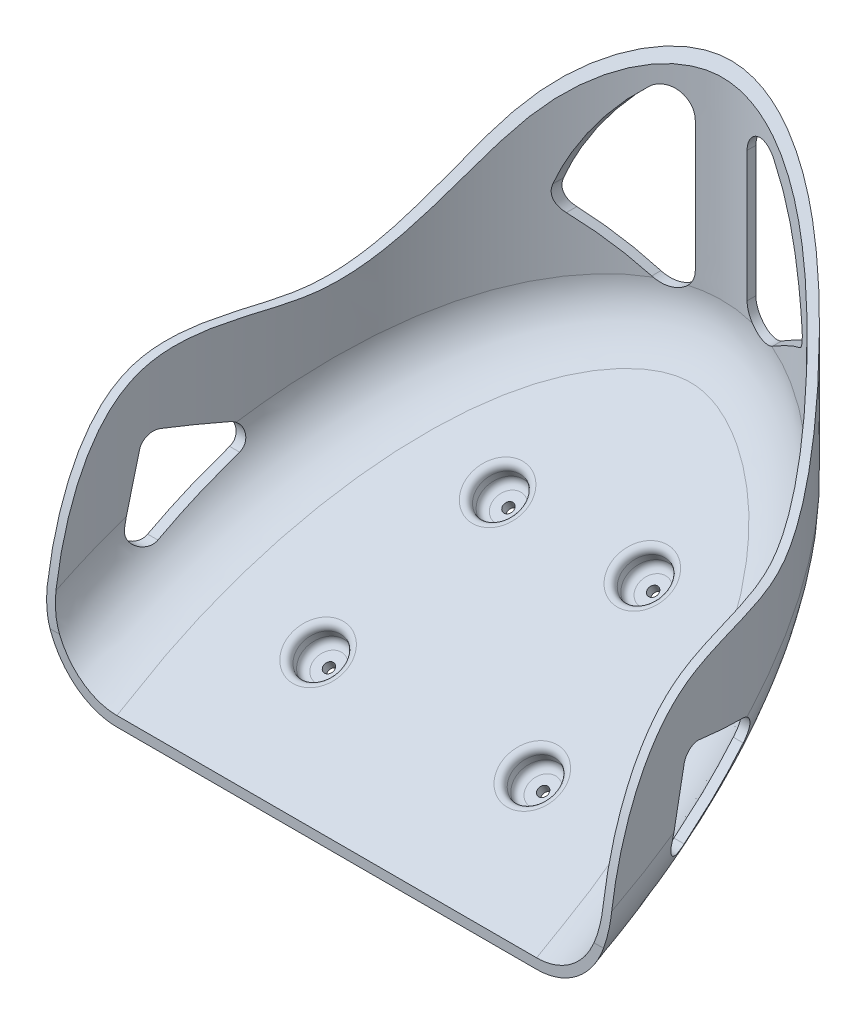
SolidWorks part; units mm, degrees
ref_plane "Plan de face" through (0, 0, 0) normal (0, 0, 1) x (1, 0, 0)
ref_plane "Plan de dessus" through (0, 0, 0) normal (0, 1, 0) x (1, 0, 0)
ref_plane "Plan de droite" through (0, 0, 0) normal (1, 0, 0) x (0, 0, -1)
sketch "Esquisse1" plane through (0, 0, 0) normal (0, 1, 0) x (1, 0, 0)
  line L0 (-195, 0) -> (195, 0)
  line L1 (-195, 0) -> (-195, -96.4904) construction
  line L2 (-92.5, 245) -> (92.5, 245) construction
  line L3 (195, 0) -> (195, -96.4904) construction
  line L4 (0, 280) -> (0, 0) construction
  spline S0 degree 3 poles (-195, 0) (-195, 84.2229) (-153.5948, 227.7236) (0, 294.3935) (153.5948, 226.1878) (195, 94.8349) (195, 0) knots 0 0 0 0 0.364326 0.5 0.635674 1 1 1 1
  point P12 (0, 245)
  dimension "D1" = 390
  dimension "D2" = 280
  dimension "D3" = 245
  dimension "D4" = 185
extrude "Boss.-Extru.1" add sketch "Esquisse1" along normal blind 400
sketch "Esquisse3" plane through (0, 0, 0) normal (1, 0, 0) x (0, 0, -1)
  line L0 (0, 0) -> (280.0014, 161.6589)
  line L1 (280.0014, 0) -> (280.0014, 400) construction
  line L2 (280.0014, 161.6589) -> (280.0014, 0)
  line L3 (0, 0) -> (280.0014, 0) construction
  line L4 (280.0014, 0) -> (0, 0)
  line L5 (0, 400) -> (0, 0) construction
  line L6 (0, 35.7616) -> (0, 400)
  line L7 (0, 400) -> (280.0014, 400)
  line L8 (280.0014, 400) -> (0, 400) construction
  line L9 (280.0014, 400) -> (280.0014, 346.411)
  line L10 (55.0833, 164.5929) -> (112.5833, 65) construction
  line L12 (150.5256, 179.282) -> (190.5256, 110) construction
  spline S0 degree 3 poles (0, 35.7616) (0.9576, 72.7127) (20.2551, 170.616) (105.9182, 175.6776) (174.8935, 175.6877) (222.7337, 252.2277) (253.1294, 302.8328) (315.2073, 369.9304) (280.0014, 346.411) knots 0 0 0 0 0.296455 0.416947 0.495512 0.714781 0.857793 1 1 1 1
  dimension "D1" = 30
  dimension "D2" = 160
  dimension "D3" = 115
  dimension "D4" = 80
  dimension "D5" = 220
  dimension "D6" = 130
extrude "Enlèv. mat.-Extru.1" cut sketch "Esquisse3" against normal through all both and the other way through all
fillet "Congé1" radius 50 1 edges at (1.9803, 161.6423, -279.9727)
shell "Coque1" thickness 6
sketch "Esquisse4" plane through (0, 0, 0) normal (0, -0.866, -0.5) x (1, 0, 0)
  line L0 (0, 0) -> (0, -294.4473) construction
  line L1 (-145, 0) -> (145, 0) construction
  line L2 (-50, -197.5) -> (50, -197.5) construction
  line L4 (-74, -82) -> (74, -82) construction
  circle A0 centre (-74, -82) radius 16.5
  circle A1 centre (74, -82) radius 16.5
  circle A2 centre (-50, -197.5) radius 16.5
  circle A3 centre (50, -197.5) radius 16.5
  spline S0 degree 3 number of poles 118 (-145, 0) -> (145, 0) construction
  point P15 (0, -82)
  point P17 (0, -197.5)
  dimension "D1" = 33
  dimension "D2" = 115.5
  dimension "D3" = 148
  dimension "D4" = 100
  dimension "D5" = 82
extrude "Boss.-Extru.2" add sketch "Esquisse4" along normal blind 15
sketch "Esquisse5" plane through (0, -12.9904, -7.5) normal (0, -0.866, -0.5) x (1, 0, 0)
  circle A0 centre (-74, -82) radius 3.5
  circle A1 centre (74, -82) radius 3.5
  circle A2 centre (50, -197.5) radius 3.5
  circle A3 centre (-50, -197.5) radius 3.5
  circle A4 centre (74, -82) radius 16.5 construction
  circle A5 centre (-74, -82) radius 16.5 construction
  dimension "D1" = 7
extrude "Enlèv. mat.-Extru.2" cut sketch "Esquisse5" against normal through all
sketch "Esquisse6" plane through (0, 5.1962, 3) normal (0, 0.866, 0.5) x (1, 0, 0)
  circle A0 centre (-50, 197.5) radius 15
  circle A1 centre (50, 197.5) radius 15
  circle A2 centre (74, 82) radius 15
  circle A3 centre (-74, 82) radius 15
  dimension "D1" = 30
extrude "Enlèv. mat.-Extru.3" cut sketch "Esquisse6" against normal blind 15
fillet "Congé2" radius 5 8 edges at (-50, 96.4462, -155.0496) (50, 96.4462, -155.0496) (74, 38.6962, -55.0237) (-74, 38.6962, -55.0237) (-50, 83.4558, -162.5496) (50, 83.4558, -162.5496) (74, 25.7058, -62.5237) (-74, 25.7058, -62.5237)
fillet "Congé3" radius 7 8 edges at (50, 94.0096, -192.8294) (-50, 94.0096, -192.8294) (-74, 36.2596, -92.8035) (74, 36.2596, -92.8035) (-50, 90.5, -156.7506) (50, 90.5, -156.7506) (74, 32.75, -56.7247) (-74, 32.75, -56.7247)
sketch "Esquisse7" plane through (0, 0, 0) normal (1, 0, 0) x (0, 0, -1)
  line L0 (61.3392, 64.7139) -> (109.6108, 97.2735)
  line L1 (106.6592, 115.2091) -> (67.8628, 125.8295)
  line L2 (55.4548, 118.3277) -> (45.9796, 75.1476)
  line L3 (0, 0) -> (255.0014, 147.2251) construction
  line L4 (57.7108, 128.6085) -> (37.9239, 151.158) construction
  line L5 (37.9239, 151.158) -> (-1.3107, 116.7301) construction
  arc A0 (61.3392, 64.7139) -> (45.9796, 75.1476) centre (55.7472, 73.0043) cw
  arc A1 (106.6592, 115.2091) -> (109.6108, 97.2735) centre (104.0189, 105.5639) cw
  arc A2 (67.8628, 125.8295) -> (55.4548, 118.3277) centre (65.2224, 116.1843) ccw
  point P10 (40.6241, 50.7414)
  point P14 (127.673, 109.4566)
  dimension "D1" = 105
  dimension "D6" = 10
  dimension "D2" = 55
  dimension "D3" = 4
  dimension "D4" = 65
  dimension "D5" = 30
extrude "Enlèv. mat.-Extru.4" cut sketch "Esquisse7" against normal through all both and the other way through all
sketch "Esquisse8" plane through (0, 0, 0) normal (0, 0, 1) x (1, 0, 0)
  line L0 (-18, 290.3193) -> (-18, 200.3193)
  line L1 (-41.9064, 188.2496) -> (-80.6774, 216.8594)
  line L2 (0, 0) -> (0, 331.0291) construction
  arc A0 (-86.1403, 233.2331) -> (-43.0614, 301.4444) centre (57.5522, 190.1929) cw
  arc A1 (-18, 290.3193) -> (-43.0614, 301.4444) centre (-33, 290.3193) ccw
  arc A2 (-80.6774, 216.8594) -> (-86.1403, 233.2331) centre (-71.771, 228.9291) cw
  arc A3 (-18, 200.3193) -> (-41.9064, 188.2496) centre (-33, 200.3193) cw
  spline S0 degree 3 number of poles 210 (-194.9951, 58.6623) -> (194.9961, 58.6962) construction
  point P5 (-86, 224.1818)
  point P6 (-26.2397, 186.9291)
  point P8 (-26.914, 304.0291)
  dimension "D1" = 15
  dimension "D7" = 150
  dimension "D2" = 18
  dimension "D3" = 42
  dimension "D4" = 27
  dimension "D5" = 90
  dimension "D6" = 68
extrude "Enlèv. mat.-Extru.5" cut sketch "Esquisse8" against normal through all
mirror "Symétrie1" about plane through (0, 0, 0) normal (1, 0, 0) of "Enlèv. mat.-Extru.5"
